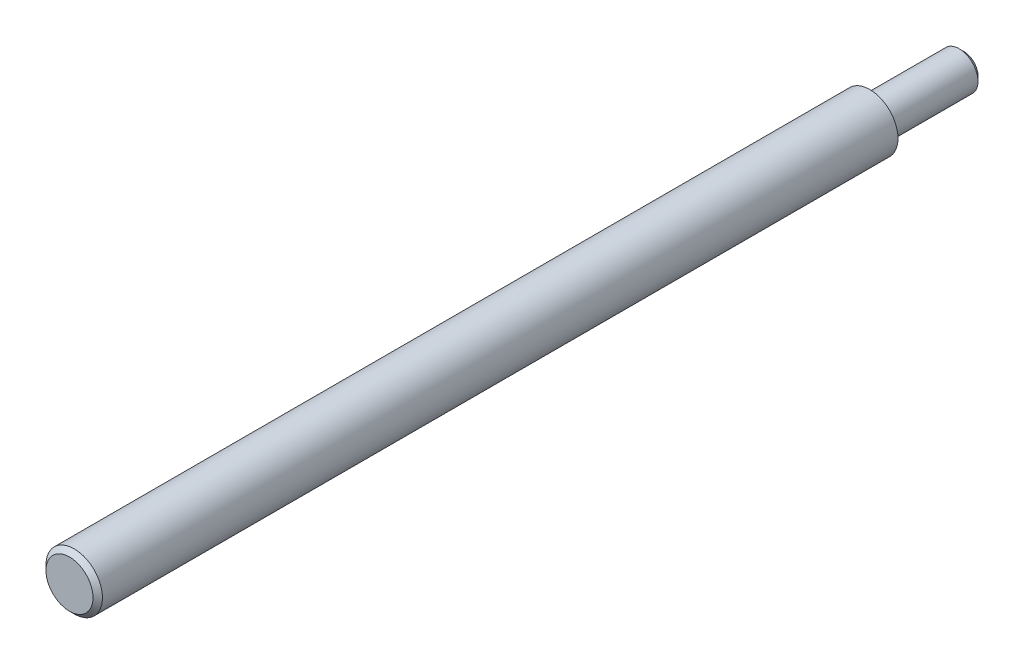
SolidWorks part; units mm, degrees
ref_plane "前视基准面" through (0, 0, 0) normal (0, 0, 1) x (1, 0, 0)
ref_plane "上视基准面" through (0, 0, 0) normal (0, 1, 0) x (1, 0, 0)
ref_plane "右视基准面" through (0, 0, 0) normal (1, 0, 0) x (0, 0, -1)
sketch "草图1" plane through (0, 0, 0) normal (0, 0, 1) x (1, 0, 0)
  circle A0 centre (0, 0) radius 6
extrude "凸台-拉伸1" add sketch "草图1" along normal blind 170
sketch "草图2" plane through (0, 0, 0) normal (0, 0, -1) x (-1, 0, 0)
  circle A0 centre (0, 0) radius 4
extrude "凸台-拉伸2" add sketch "草图2" along normal blind 20
chamfer "倒角1" distance 1 angle 45 1 edges at (6, 0, 170)
chamfer "倒角2" distance 1 angle 45 1 edges at (-4, 0, -20)
